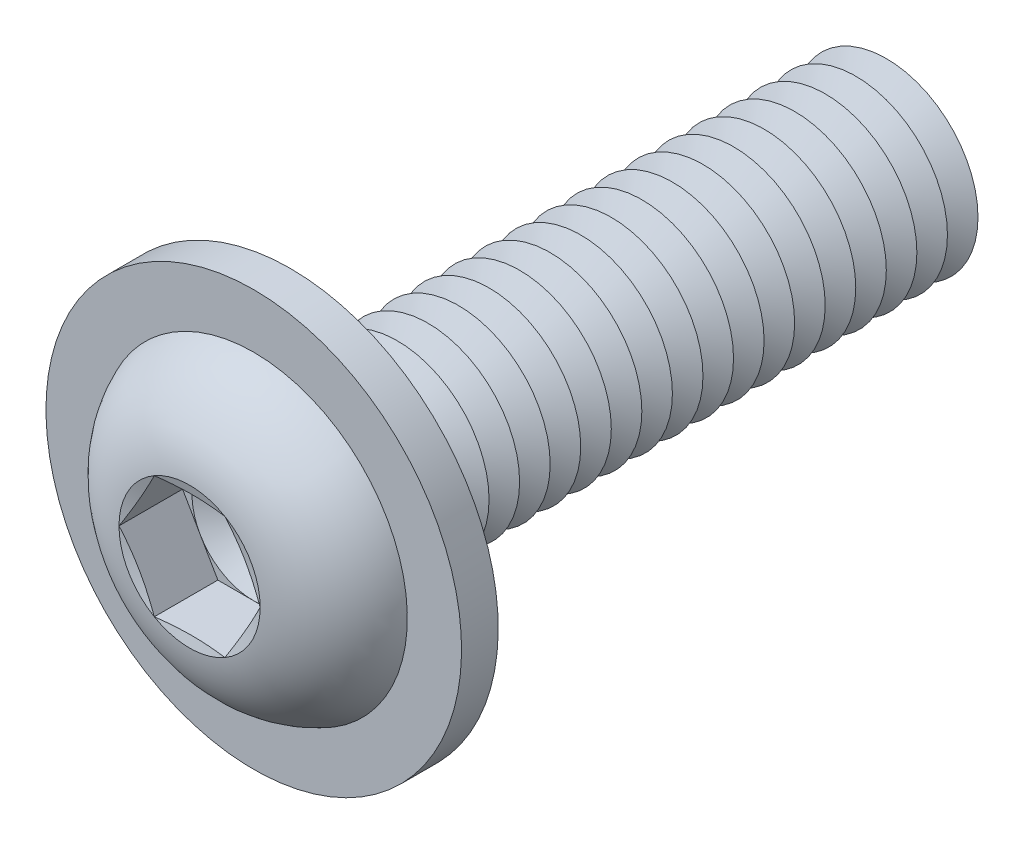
SolidWorks part; units mm, degrees
ref_plane "Front Plane" through (0, 0, 0) normal (0, 0, 1) x (1, 0, 0)
ref_plane "Top Plane" through (0, 0, 0) normal (0, 1, 0) x (1, 0, 0)
ref_plane "Right Plane" through (0, 0, 0) normal (1, 0, 0) x (0, 0, -1)
sketch "Sketch1" plane through (0, 0, 0) normal (1, 0, 0) x (0, 0, -1)
  line L0 (0, 3) -> (0, 5.25)
  line L3 (0, 3) -> (20, 3)
  line L4 (20, 3) -> (20, 0)
  line L5 (20, 0) -> (-3.3, 0) construction
  line L6 (-3.3, 0) -> (20, 0)
  line L7 (-3.3, 2.3094) -> (-3.3, 1.1547) construction
  line L8 (-3.3, 1.1547) -> (-3.3, 0)
  line L9 (-3.3, 2.3094) -> (-2.9906, 1.1547)
  line L10 (-2.9906, 1.1547) -> (-3.3, 1.1547)
  line L11 (20, 0) -> (22.7481, 0) construction
  line L12 (0, 5.25) -> (-3.3, 5.25) construction
  arc A1 (0, 5.25) -> (-3.3, 2.3094) centre (0, 1.928) ccw
  point P8 (20, 1.5)
  dimension "D1" = 10.5
  dimension "D2" = 6
  dimension "D3" = 3.3
  dimension "D4" = 4.6188
  dimension "D5" = 20
  dimension "D6" = 15
revolve "Revolve1" add sketch "Sketch1" angle 360 about L5
fillet "Fillet1" radius 0.5 1 edges at (-3, 0, 0)
sketch "Sketch2" plane through (0, 0, 0) normal (1, 0, 0) x (0, 0, -1)
  line L0 (19.5, 3) -> (20.5, 3)
  line L1 (20, 3) -> (0.5, 3) construction
  line L2 (20.5, 3) -> (20, 2.134)
  line L3 (20, -3) -> (20, 3) construction
  line L4 (20, 2.134) -> (19.5, 3)
  dimension "D1" = 1
revolve "Cut-Revolve1" cut sketch "Sketch2" angle 360 about axis through (0, 0, -20) along (0, 0, -1)
pattern_linear "LPattern1" count 20 spacing 1 along (0, 0, 1) of "Cut-Revolve1"
sketch "Sketch3" plane through (0, 0, 3.3) normal (0, 0, 1) x (1, 0, 0)
  line L7 (1.1547, 2) -> (-1.1547, 2)
  line L8 (-1.1547, 2) -> (-2.3094, 0)
  line L9 (-2.3094, 0) -> (-1.1547, -2)
  line L10 (-1.1547, -2) -> (1.1547, -2)
  line L11 (1.1547, -2) -> (2.3094, 0)
  line L12 (2.3094, 0) -> (1.1547, 2)
  circle A0 centre (0, 0) radius 2 construction
  circle A3 centre (0, 0) radius 2.3094 construction
extrude "Cut-Extrude1" cut sketch "Sketch3" against normal blind 2.08
sketch "Sketch4" plane through (0, 0, 1.22) normal (0, 0, 1) x (1, 0, 0)
  line L1 (1.1547, 2) -> (-1.1547, 2) construction
  circle A0 centre (0, 0) radius 2
extrude "Cut-Extrude2" cut sketch "Sketch4" against normal through all draft 60
sketch "Sketch5" plane through (0, 0, 0) normal (0, 0, -1) x (-1, 0, 0)
  circle A0 centre (0, 0) radius 6.8
  circle A1 centre (0, 0) radius 3.5
  circle A2 centre (0, 0) radius 3.5 construction
  dimension "D1" = 13.6
extrude "Boss-Extrude1" add sketch "Sketch5" against normal blind 1.2
